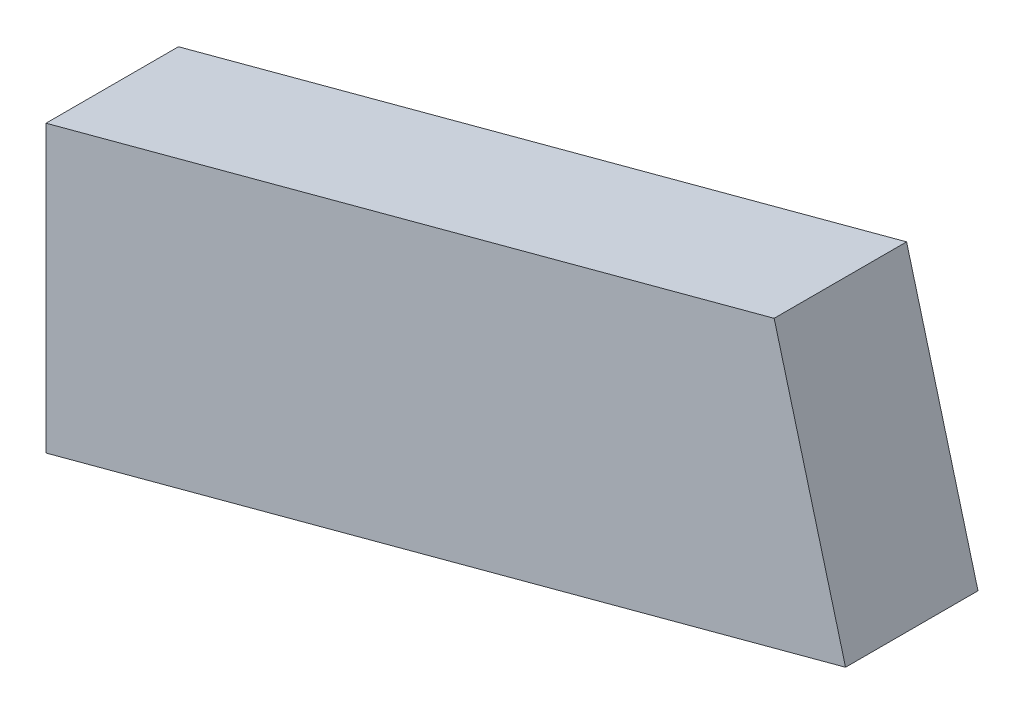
SolidWorks part; units mm, degrees
ref_plane "Front Plane" through (0, 0, 0) normal (0, 0, 1) x (1, 0, 0)
ref_plane "Top Plane" through (0, 0, 0) normal (0, 1, 0) x (1, 0, 0)
ref_plane "Right Plane" through (0, 0, 0) normal (1, 0, 0) x (0, 0, -1)
sketch "Sketch1" plane through (0, 0, 0) normal (0, 0, 1) x (1, 0, 0)
  line L0 (0, 0) -> (0, 25.8819)
  line L1 (0, 25.8819) -> (65.974, 43.5596)
  line L2 (65.974, 43.5596) -> (72.4444, 19.4114)
  line L3 (72.4444, 19.4114) -> (0, 0)
  dimension "D1" = 75
  dimension "D2" = 25
  dimension "D3" = 75
extrude "Boss-Extrude1" add sketch "Sketch1" along normal blind 12
